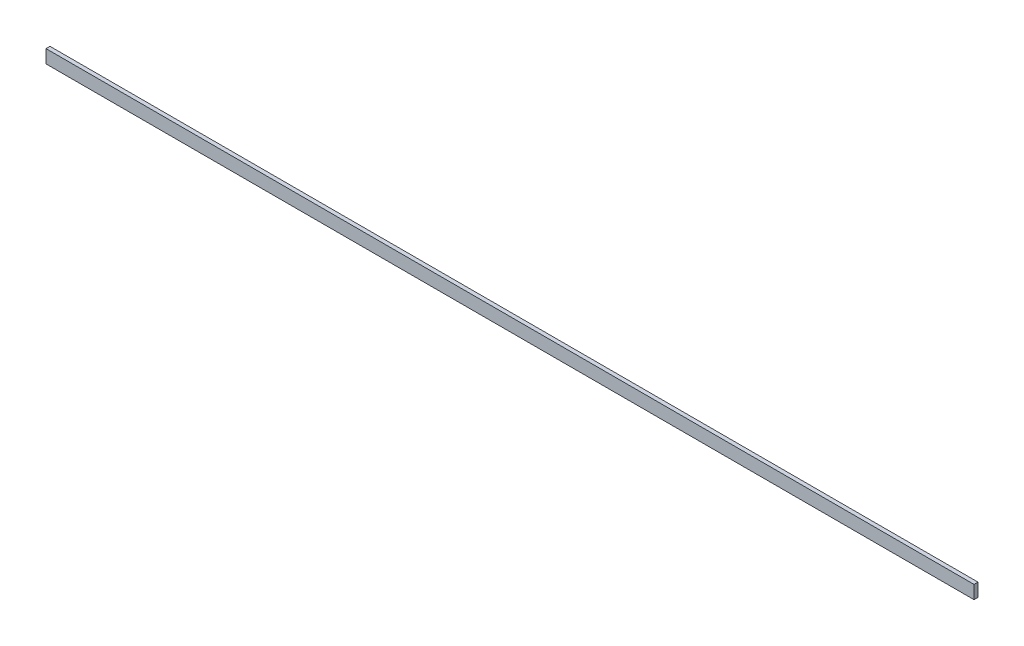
SolidWorks part; units mm, degrees
ref_plane "Ebene vorne" through (0, 0, 0) normal (0, 0, 1) x (1, 0, 0)
ref_plane "Ebene oben" through (0, 0, 0) normal (0, 1, 0) x (1, 0, 0)
ref_plane "Ebene rechts" through (0, 0, 0) normal (1, 0, 0) x (0, 0, -1)
sketch "Skizze1" plane through (0, 0, 0) normal (0, 0, 1) x (1, 0, 0)
  line L1 (-350, -5) -> (350, -5)
  line L2 (-350, -5) -> (-350, 5)
  line L3 (-350, 5) -> (350, 5)
  line L4 (350, -5) -> (350, 5)
  line L5 (-350, -5) -> (350, 5) construction
  line L6 (-350, 5) -> (350, -5) construction
  point P0 (0, 0)
  dimension "D1" = 700
  dimension "D2" = 10
extrude "Aufsatz-Linear austragen1" add sketch "Skizze1" along normal blind 3
